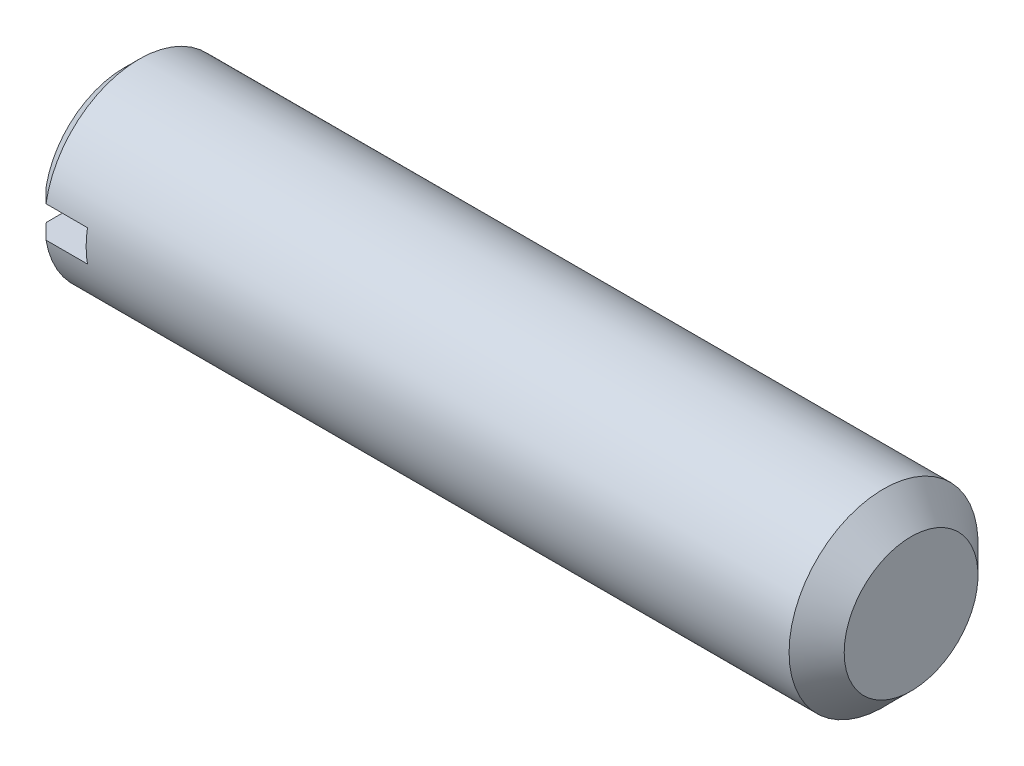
SolidWorks part; units mm, degrees
ref_plane "Front Plane" through (0, 0, 0) normal (0, 0, 1) x (1, 0, 0)
ref_plane "Top Plane" through (0, 0, 0) normal (0, 1, 0) x (1, 0, 0)
ref_plane "Right Plane" through (0, 0, 0) normal (1, 0, 0) x (0, 0, -1)
sketch "BodySke" plane through (0, 0, 0) normal (0, 0, 1) x (1, 0, 0)
  line L0 (0, 0) -> (88.3411, 0) construction
  line L1 (0, 0) -> (0, 5.036)
  line L2 (0, 5.036) -> (0.964, 6)
  line L3 (0.964, 6) -> (48.25, 6)
  line L4 (50, 4.25) -> (48.25, 6)
  line L5 (50, 4.25) -> (50, 0)
  line L6 (50, 0) -> (0, 0)
  line L7 (1.75, 0) -> (1.75, 8.5388) construction
  line L8 (0, -5.036) -> (0.964, -6) construction
  dimension "Diameter" = 12
  dimension "Thread_minor" = 10.072
  dimension "Length" = 50
  dimension "Cup_dia" = 8.5
  dimension "Nose_chamfer_angle" = 45
  dimension "Drive_chamfer_angle" = 90
  dimension "Advance" = 1.75
revolve "BaseBody" add sketch "BodySke" angle 360 about L0
sketch "SlotSke" plane through (0, 0, 0) normal (1, 0, 0) x (0, 0, -1)
  line L0 (-6, 1) -> (6, -1) construction
  line L1 (-6, 1) -> (6, 1)
  line L2 (-6, 1) -> (-6, -1)
  line L3 (-6, -1) -> (6, -1)
  line L4 (6, 1) -> (6, -1)
  dimension "D1" = 12
  dimension "Slot_width" = 2
extrude "Slot" cut sketch "SlotSke" along normal blind 3.6
sketch "ThdSchSke" plane through (0, 0, 0) normal (0, 0, 1) x (1, 0, 0)
  line L0 (0, 0) -> (53.6961, 0) construction
  line L1 (1.6009, 7.1131) -> (1.6009, 6)
  line L2 (1.6009, 7.1131) -> (2.714, 7.1131)
  line L3 (2.714, 7.1131) -> (2.714, 6)
  line L4 (2.714, 6) -> (2.1574, 5.036)
  line L5 (2.1574, 5.036) -> (1.6009, 6)
  dimension "D1" = 1.75
revolve "ThreadSchematic" [suppressed] cut sketch "ThdSchSke" angle 360 about L0
pattern_linear "ThdSchPat" [suppressed]
equation "\"Thread_minor@ThreadCosmetic\" = \"Thread_minor@BodySke\""
equation "\"D1@SlotSke\" = \"Diameter@BodySke\""
equation "\"D1@ThdSchSke\" = \"Advance@BodySke\""
equation "\"Advance@ThdSchPat\" = \"Advance@BodySke\""
equation "\"Tooth_Num@ThdSchPat\" =  int( \"Length@BodySke\" / \"Advance@BodySke\" )  - 1"
